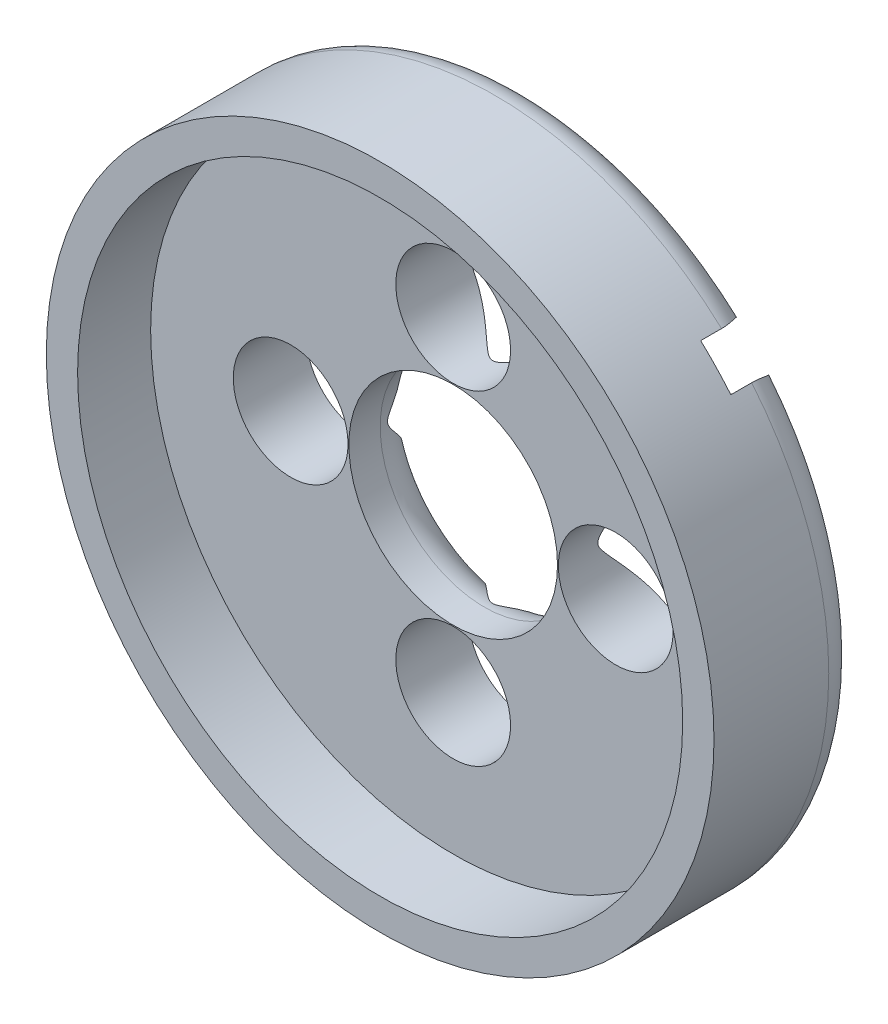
SolidWorks part; units mm, degrees
ref_plane "Front" through (0, 0, 0) normal (0, 0, 1) x (1, 0, 0)
ref_plane "Top" through (0, 0, 0) normal (0, 1, 0) x (1, 0, 0)
ref_plane "Right" through (0, 0, 0) normal (1, 0, 0) x (0, 0, -1)
sketch "Эскиз2" plane through (0, 0, 0) normal (0, 0, 1) x (1, 0, 0)
  circle A0 centre (0, 0) radius 32
  circle A1 centre (0, 0) radius 10
  circle A2 centre (0, 15.5782) radius 5.5
  circle A3 centre (15.5782, 0) radius 5.5
  circle A4 centre (0, -15.5782) radius 5.5
  circle A5 centre (-15.5782, 0) radius 5.5
  point P6 (0, 0)
  point P7 (0, 0)
  point P8 (0, 0)
  point P15 (0, 0)
  point P16 (0, 0)
  dimension "D1" = 64
  dimension "D2" = 20
  dimension "D3" = 11
  dimension "D4" = 4
extrude "Бобышка-Вытянуть1" add sketch "Эскиз2" against normal blind 7
sketch "Эскиз6" plane through (0, 0, -7) normal (0, 0, -1) x (-1, 0, 0)
  circle A0 centre (-18.531, 17.4351) radius 2
  circle A1 centre (0, 0) radius 23
  circle A2 centre (17.4351, 18.531) radius 2
  circle A3 centre (18.531, -17.4351) radius 2
  circle A4 centre (-17.4351, -18.531) radius 2
  point P14 (0, 0)
  dimension "D1" = 4
  dimension "D2" = 46
  dimension "D3" = 4
extrude "Вырез-Вытянуть2" cut sketch "Эскиз6" against normal blind 15 contours A0
sketch "Эскиз11" plane through (0, 0, -7) normal (0, 0, -1) x (-1, 0, 0)
  line L0 (-18.7345, 17.5649) -> (-22.6147, 21.4451) construction
  line L1 (-20.315, 15.9844) -> (-24.1952, 19.8646)
  line L2 (-17.154, 19.1454) -> (-21.0342, 23.0256)
  arc A0 (-20.315, 15.9844) -> (-17.154, 19.1454) centre (-18.7345, 17.5649) ccw
  arc A1 (-21.0342, 23.0256) -> (-24.1952, 19.8646) centre (-22.6147, 21.4451) ccw
  point P2 (-20.6746, 19.505)
extrude "Вырез-Вытянуть6" cut sketch "Эскиз11" against normal blind 5
sketch "Эскиз12" plane through (0, 0, 0) normal (0, 0, 1) x (1, 0, 0)
  circle A0 centre (0, 0) radius 29
  dimension "D1" = 58
sketch "Эскиз15" plane through (0, 0, 0) normal (0, 0, 1) x (1, 0, 0)
  circle A0 centre (0, 0) radius 29
  circle A2 centre (0, 0) radius 32
  dimension "D1" = 58
  dimension "D2" = 64
extrude "Бобышка-Вытянуть3" add sketch "Эскиз15" along normal blind 7
fillet "Скругление1" radius 4 1 edges at (10, 0, -7)
fillet "Скругление3" radius 3 1 edges at (-23.2199, -22.019, -7)
